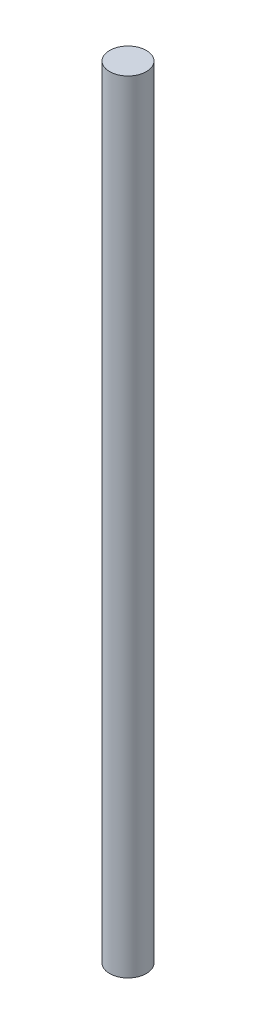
SolidWorks part; units mm, degrees
ref_plane "Plan de face" through (0, 0, 0) normal (0, 0, 1) x (1, 0, 0)
ref_plane "Plan de dessus" through (0, 0, 0) normal (0, 1, 0) x (1, 0, 0)
ref_plane "Plan de droite" through (0, 0, 0) normal (1, 0, 0) x (0, 0, -1)
sketch "Esquisse1" plane through (0, 0, 0) normal (0, 1, 0) x (1, 0, 0)
  circle A0 centre (0, 0) radius 4
  dimension "D1" = 8
extrude "Boss.-Extru.1" add sketch "Esquisse1" along normal mid plane 170
ref_plane "Plan1" through (0, 0, 65) normal (0, 0, 1) x (1, 0, 0)
ref_plane "Plan2" through (0, 0, 20) normal (0, 0, 1) x (1, 0, 0)
